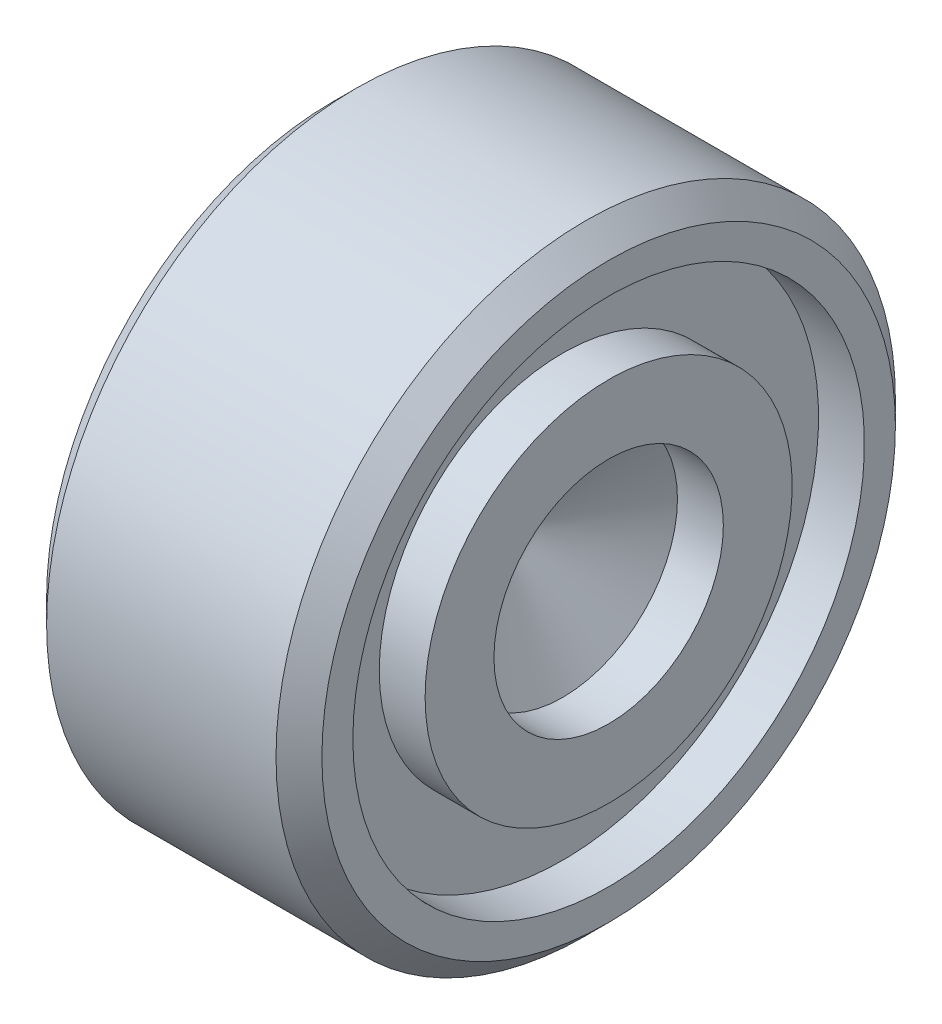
SolidWorks part; units mm, degrees
ref_plane "前视" through (0, 0, 0) normal (0, 0, 1) x (1, 0, 0)
ref_plane "上视" through (0, 0, 0) normal (0, 1, 0) x (1, 0, 0)
ref_plane "右视" through (0, 0, 0) normal (1, 0, 0) x (0, 0, -1)
sketch "草图1" plane through (0, 0, 0) normal (0, 0, 1) x (1, 0, 0)
  line L0 (0, 0) -> (78.0447, 0) construction
  line L1 (0, 0) -> (0, 13.5)
  line L2 (0, 13.5) -> (12, 13.5)
  line L3 (12, 13.5) -> (12, 11.15)
  line L4 (12, 11.15) -> (10, 11.15)
  line L5 (10, 11.15) -> (10, 8)
  line L6 (10, 8) -> (12, 8)
  line L7 (12, 8) -> (12, 5)
  line L8 (12, 5) -> (10, 5)
  line L9 (10, 5) -> (7.1132, 0)
  line L10 (7.1132, 0) -> (0, 0)
  dimension "D1" = 10
  dimension "D2" = 60
  dimension "D3" = 2
  dimension "D4" = 16
  dimension "D5" = 22.3
  dimension "D6" = 2
  dimension "D7" = 27
  dimension "D8" = 12
revolve "旋转1" add sketch "草图1" angle 360 about L0
ref_plane "基准面1" through (0, 9, 0) normal (0, 1, 0) x (-1, 0, 0)
sketch "草图3" plane through (0, 9, 0) normal (0, 1, 0) x (-1, 0, 0)
  line L0 (0, 0) -> (-5.146, 0) construction
  line L1 (0, 0) -> (-78.0447, 0) construction
  line L2 (0, -13.5) -> (0, 13.5) construction
  line L3 (0, -2) -> (0, 0)
  line L4 (0, -2) -> (-4, -2)
  line L5 (-4, -2) -> (-5.1547, 0)
  line L6 (-5.1547, 0) -> (0, 0)
  line L7 (0, 0) -> (-10.0992, 0) construction
  dimension "D1" = 4
  dimension "D2" = 60
  dimension "D3" = 4
revolve "切除-旋转1" cut sketch "草图3" angle 360 about L7
pattern_circular "阵列(圆周)1" count 4 over 360 about axis through (0, 0, 0) along (1, 0, 0)
chamfer "倒角1" distance 1 angle 45
sketch "草图4" plane through (0, 0, 0) normal (0, 0, 1) x (1, 0, 0)
  line L1 (-2.3272, 14.5312) -> (13.8309, 14.5312)
  line L2 (-2.3272, 14.5312) -> (-2.3272, -14.1452)
  line L3 (-2.3272, -14.1452) -> (13.8309, -14.1452)
  line L4 (13.8309, 14.5312) -> (13.8309, -14.1452)
extrude "切除-拉伸1" cut sketch "草图4" along normal through all
